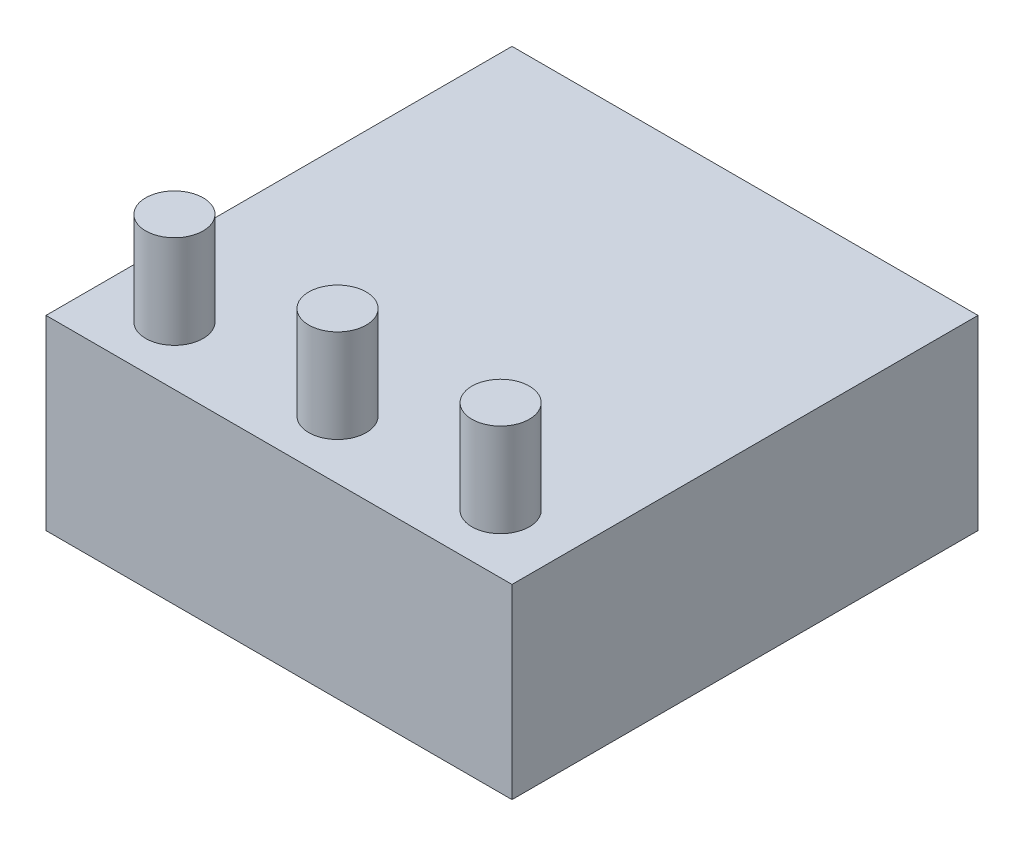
SolidWorks part; units mm, degrees
ref_plane "Front" through (0, 0, 0) normal (0, 0, 1) x (1, 0, 0)
ref_plane "Top" through (0, 0, 0) normal (0, 1, 0) x (1, 0, 0)
ref_plane "Right" through (0, 0, 0) normal (1, 0, 0) x (0, 0, -1)
sketch "Sketch2" plane through (0, 0, 0) normal (0, 1, 0) x (1, 0, 0)
  line L0 (25, -25) -> (-25, 25) construction
  line L1 (-25, 25) -> (25, 25)
  line L2 (-25, 25) -> (-25, -25)
  line L3 (-25, -25) -> (25, -25)
  line L4 (25, 25) -> (25, -25)
  dimension "D1" = 50
  dimension "D2" = 50
extrude "Extrude1" add sketch "Sketch2" along normal blind 20
sketch "Sketch4" plane through (0, 20, 0) normal (0, 1, 0) x (-1, 0, 0)
  line L0 (-25, 25) -> (-25, -25) construction
  line L1 (25, -25) -> (25, 25) construction
  circle A0 centre (-17.5, 18.7198) radius 3.0799
  circle A1 centre (0, 18.7198) radius 3.0799
  circle A2 centre (17.5, 18.7198) radius 3.0799
  dimension "D1" = 7.5
  dimension "D2" = 7.5
extrude "Extrude3" add sketch "Sketch4" along normal blind 10
